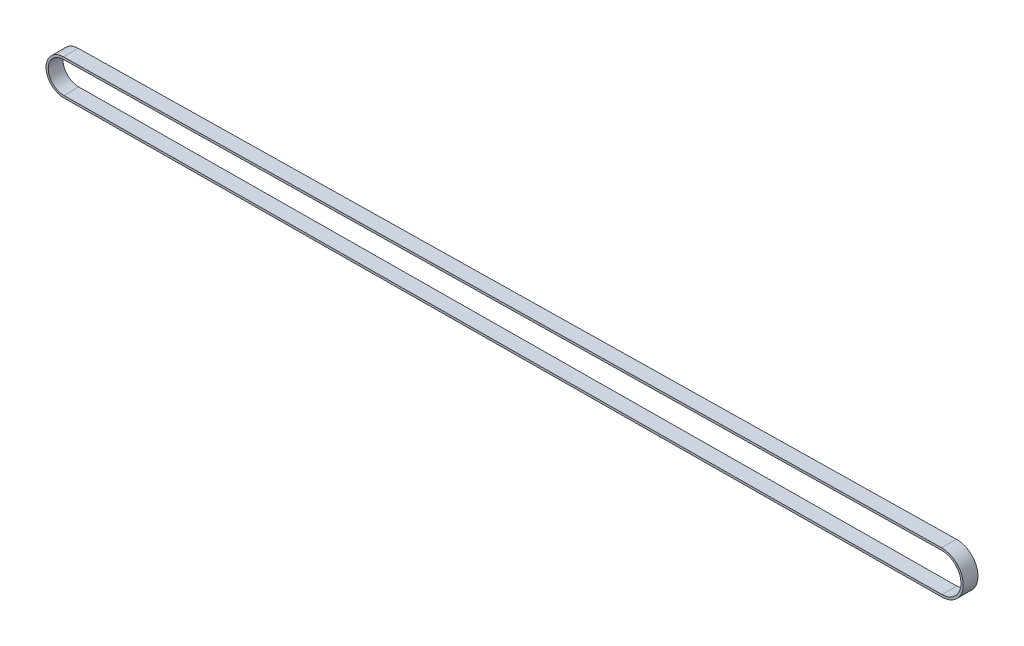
SolidWorks part; units mm, degrees
ref_plane "Front Plane" through (0, 0, 0) normal (0, 0, 1) x (1, 0, 0)
ref_plane "Top Plane" through (0, 0, 0) normal (0, 1, 0) x (1, 0, 0)
ref_plane "Right Plane" through (0, 0, 0) normal (1, 0, 0) x (0, 0, -1)
sketch "Sketch2" plane through (14.3477, -36.7107, 0) normal (0, 0, 1) x (1, 0, 0)
  line L0 (0, 0) -> (1, 0) construction
  line L1 (0, 0) -> (0, 1) construction
  line L2 (0.4151, 0.4) -> (296.6461, 5.094)
  line L3 (296.7977, -7.755) -> (0.5384, -10.0492)
  arc A0 (0.5384, -10.0492) -> (0.4151, 0.4) centre (0.4979, -4.8244) cw
  arc A1 (296.6461, 5.094) -> (296.7977, -7.755) centre (296.7479, -1.3302) cw
extrude "Extrude-Thin1" add sketch "Sketch2" along normal mid plane 5 thin
